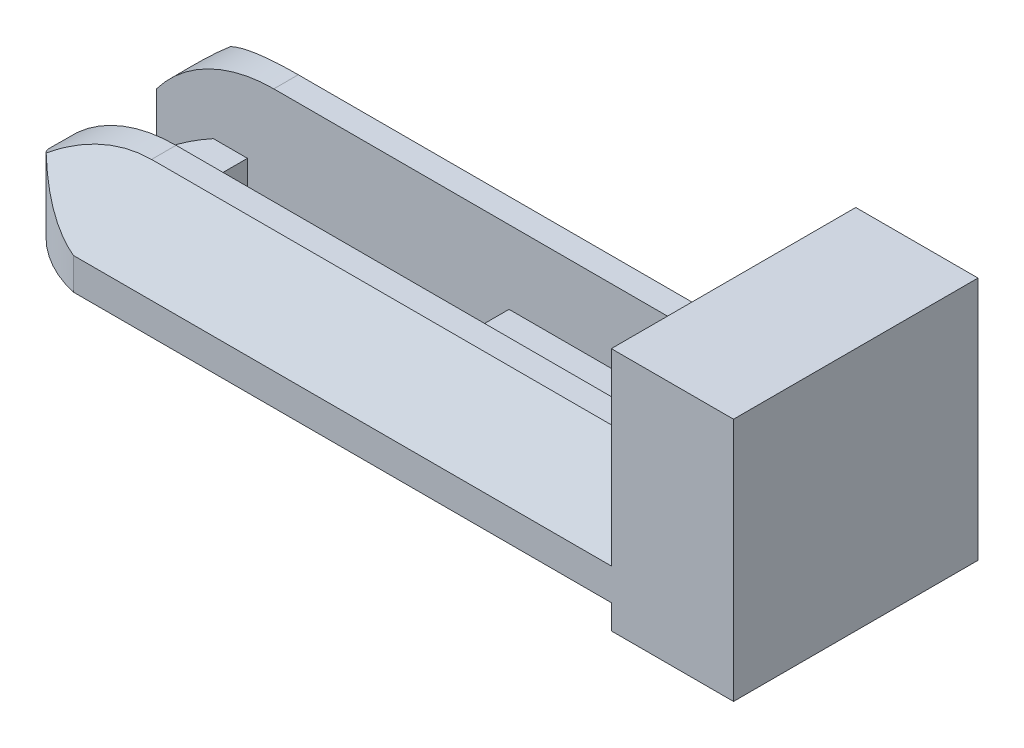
SolidWorks part; units mm, degrees
ref_plane "Front Plane" through (0, 0, 0) normal (0, 0, 1) x (1, 0, 0)
ref_plane "Top Plane" through (0, 0, 0) normal (0, 1, 0) x (1, 0, 0)
ref_plane "Right Plane" through (0, 0, 0) normal (1, 0, 0) x (0, 0, -1)
sketch "Sketch9" plane through (0, 0, 0) normal (0, 1, 0) x (1, 0, 0)
  line L1 (0, 0) -> (22, 0)
  line L3 (0, 10) -> (22, 10)
  line L4 (22, 0) -> (22, 10)
  arc A0 (0, 10) -> (0, 0) centre (1.125, 5) ccw
  dimension "D1" = 10
  dimension "D2" = 22
extrude "Boss-Extrude2" add sketch "Sketch9" along normal blind 2.3
ref_plane "Plane1" through (22, 0, 0) normal (1, 0, 0) x (0, 0, -1)
sketch "Sketch11" plane through (22, 0, 0) normal (1, 0, 0) x (0, 0, -1)
  line L0 (7, 5.3) -> (8, 5.3)
  line L1 (8, 5.3) -> (10, 2.3)
  line L2 (7, 2.3) -> (10, 2.3)
  line L3 (7, 5.3) -> (7, 2.3)
  dimension "D1" = 3
  dimension "D2" = 1
  dimension "D3" = 3
extrude "Boss-Extrude3" add sketch "Sketch11" against normal blind 26
sketch "Sketch12" plane through (22, 0, 0) normal (1, 0, 0) x (0, 0, -1)
  line L0 (0, 2.3) -> (0, 0) construction
  line L1 (3, 5.3) -> (2, 5.3)
  line L2 (3, 5.3) -> (3, 2.3)
  line L3 (2, 5.3) -> (0, 2.3)
  line L4 (0, 2.3) -> (3, 2.3)
  dimension "D1" = 3
  dimension "D2" = 3
  dimension "D3" = 1
extrude "Boss-Extrude4" add sketch "Sketch12" against normal blind 26
fillet "Fillet7" radius 6 1 edges at (-4, 5.3, -7.5)
sketch "Sketch14" plane through (0, 2.3, 0) normal (0, -1, 0) x (1, 0, 0)
  line L0 (-3.5936, -7) -> (-4, -7)
  line L1 (-4, -7) -> (-4, -10)
  line L2 (-4, -10) -> (0, -10)
  arc A0 (0, -10) -> (-3.5936, -7) centre (1.125, -5) cw
extrude "Cut-Extrude2" cut sketch "Sketch14" against normal blind 3
fillet "Fillet8" radius 6 1 edges at (-4, 5.3, -2.5)
sketch "Sketch15" plane through (0, 2.3, 0) normal (0, -1, 0) x (1, 0, 0)
  line L0 (0, 0) -> (-4, 0)
  line L1 (-4, 0) -> (-4, -3)
  line L2 (-4, -3) -> (-3.5936, -3)
  arc A0 (-3.5936, -3) -> (0, 0) centre (1.125, -5) cw
extrude "Cut-Extrude3" cut sketch "Sketch15" against normal blind 3
chamfer "Chamfer1" distance 1 angle 45 3 edges at (11, 0, 0) (11, 0, -10) (-4, 0, -5)
chamfer "Chamfer2" distance 2 angle 45 1 edges at (-4, 2.3, -5)
sketch "Sketch16" plane through (0, 0, 0) normal (0, -1, 0) x (1, 0, 0)
  line L0 (0.1172, -3) -> (10.1172, -3)
  line L1 (0.1172, -3) -> (0.1172, -7)
  line L2 (10.1172, -3) -> (10.1172, -7)
  line L3 (10.1172, -7) -> (0.1172, -7)
  dimension "D1" = 4
  dimension "D2" = 2
  dimension "D3" = 10
extrude "Cut-Extrude4" cut sketch "Sketch16" against normal blind 3
chamfer "Chamfer3" distance 3 angle 45 1 edges at (10.1172, 0, -5)
chamfer "Chamfer4" distance 1 angle 45 2 edges at (6.6172, 0, -3) (6.6172, 0, -7)
sketch "Sketch17" plane through (22, 0, 0) normal (1, 0, 0) x (0, 0, -1)
  line L0 (0, 0) -> (10, 0)
  line L1 (10, 0) -> (10, 10)
  line L2 (10, 10) -> (0, 10)
  line L3 (0, 10) -> (0, 0)
  line L4 (1, 0) -> (9, 0) construction
  point P12 (5, 0)
  point P14 (5, 0)
  dimension "D1" = 10
  dimension "D2" = 10
extrude "Boss-Extrude5" add sketch "Sketch17" along normal blind 5
